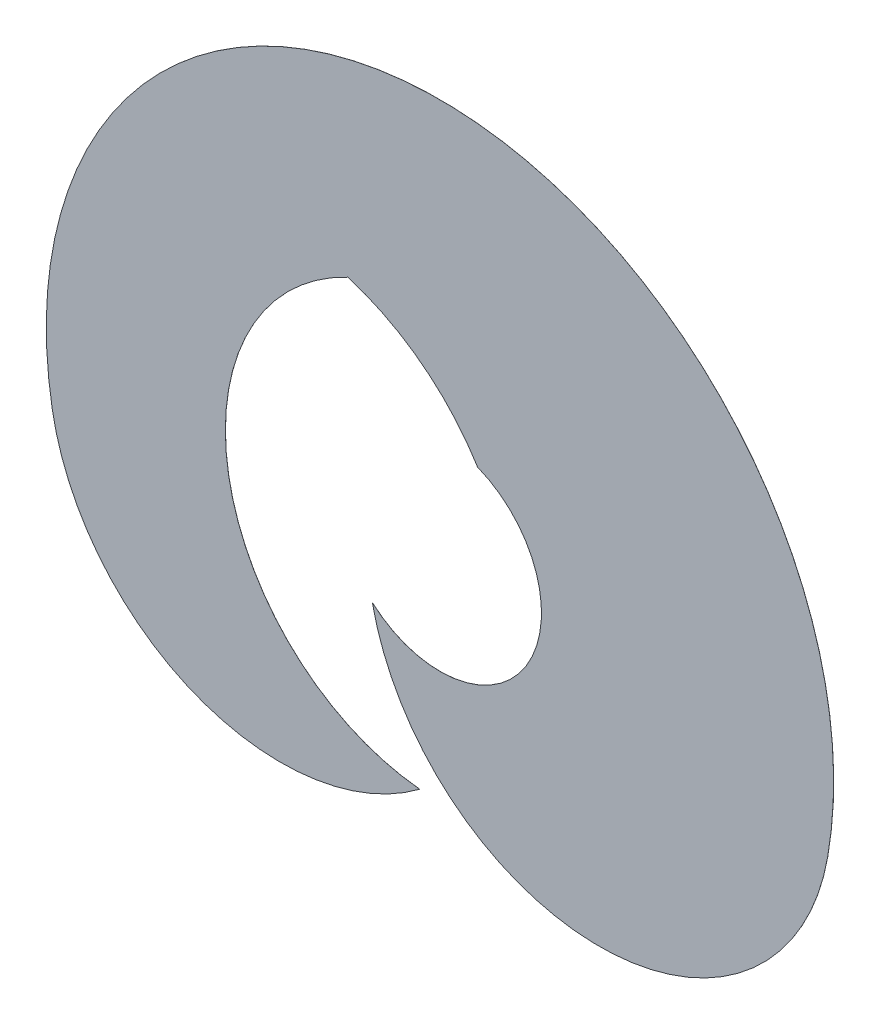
SolidWorks part; units mm, degrees
ref_plane "前视基准面" through (0, 0, 0) normal (0, 0, 1) x (1, 0, 0)
ref_plane "上视基准面" through (0, 0, 0) normal (0, 1, 0) x (1, 0, 0)
ref_plane "右视基准面" through (0, 0, 0) normal (1, 0, 0) x (0, 0, -1)
sketch "草图1" plane through (0, 0, 0) normal (0, 0, 1) x (1, 0, 0)
  line L0 (0, 0) -> (0, 1951.8831) construction
  line L1 (250, 607) -> (250, 1777) construction
  line L2 (250, 1777) -> (250, 3453.969) construction
  line L3 (250, 3453.969) -> (448.5725, 1800.8526) construction
  line L4 (448.5725, 1800.8526) -> (250, 1777) construction
  line L5 (250, 607) -> (1402.2251, 403.8316) construction
  line L6 (250, 607) -> (-902.2251, 403.8316) construction
  line L7 (250, 1777) -> (874.1189, 220.4973) construction
  line L8 (250, 1777) -> (443.1852, 1828.7638) construction
  line L9 (443.1852, 1828.7638) -> (874.1189, 220.4973) construction
  line L10 (250, 1777) -> (-1246.1842, 1019.5979) construction
  line L11 (250, 1777) -> (318.404, 1589.0615) construction
  line L12 (318.404, 1589.0615) -> (-1246.1842, 1019.5979) construction
  line L13 (250, 1777) -> (-59.9278, 1777) construction
  arc A0 (3053.7171, 112.629) -> (-2553.7171, 112.629) centre (250, 607) ccw
  arc A1 (-239.008, 59.4784) -> (522.2537, 1288.7526) centre (250, 607) ccw
  arc A2 (-239.008, 59.4784) -> (250, -814.611) centre (1402.2251, 403.8316) ccw
  arc A4 (522.2537, 1288.7526) -> (-416.1393, 2008.8069) centre (-902.2251, 403.8316) ccw
  arc A5 (-2553.7171, 112.629) -> (103.48, -938.1007) centre (-902.2251, 403.8316) ccw
  arc A6 (250, -814.611) -> (3053.7171, 112.629) centre (1402.2251, 403.8316) ccw
  arc A7 (-416.1393, 2008.8069) -> (103.48, -938.1007) centre (250, 607) ccw
  dimension "D2" = 250
  dimension "D3" = 1170
  dimension "D4" = 200
  dimension "D5" = 1665
  dimension "D6" = 100
  dimension "D7" = 1170
  dimension "D8" = 100
  dimension "D9" = 1170
  dimension "D10" = 165
  dimension "D11" = 200
  dimension "D12" = 1665
  dimension "D13" = 1665
  dimension "D14" = 200
  dimension "D16" = 607
  dimension "D17" = 110
extrude "凸台-拉伸1" add sketch "草图1" along normal blind 0.5
